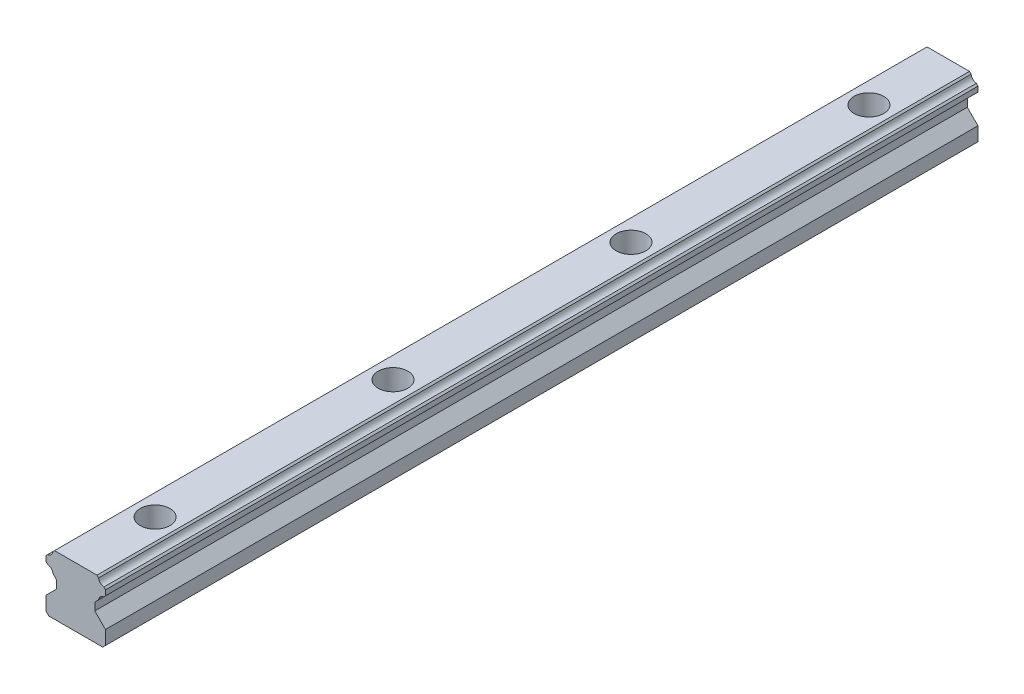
SolidWorks part; units mm, degrees
ref_plane "Front Plane" through (0, 0, 0) normal (0, 0, 1) x (1, 0, 0)
ref_plane "Top Plane" through (0, 0, 0) normal (0, 1, 0) x (1, 0, 0)
ref_plane "Right Plane" through (0, 0, 0) normal (1, 0, 0) x (0, 0, -1)
sketch "Sketch2" plane through (0, 0, 0) normal (0, 0, 1) x (1, 0, 0)
  line L0 (-4.8, 8.84) -> (-4.8, 6.9)
  line L1 (-4.8, 6.9) -> (-7.5, 4.2)
  line L2 (-7.5, 4.2) -> (-7.5, 0.7)
  line L3 (-6.8, 0) -> (-7.5, 0.7)
  line L4 (6.8, 0) -> (-6.8, 0)
  line L5 (7.5, 0.7) -> (6.8, 0)
  line L6 (7.5, 0.7) -> (7.5, 4.2)
  line L7 (7.5, 4.2) -> (4.8, 6.9)
  line L8 (4.8, 6.9) -> (4.8, 8.84)
  line L9 (5.7542, 9.7942) -> (4.8, 8.84)
  line L10 (7.5, 11.54) -> (7.0943, 11.1343)
  line L11 (7.5, 12.85) -> (7.5, 11.54)
  line L12 (7.0816, 13.2684) -> (7.5, 12.85)
  line L13 (5.35, 15) -> (5.7559, 14.5941)
  line L14 (5.35, 15) -> (-5.35, 15)
  line L15 (-5.7559, 14.5941) -> (-5.35, 15)
  line L16 (-7.5, 12.85) -> (-7.0816, 13.2684)
  line L17 (-7.5, 11.54) -> (-7.5, 12.85)
  line L18 (-7.0943, 11.1343) -> (-7.5, 11.54)
  line L19 (-4.8, 8.84) -> (-5.7542, 9.7942)
  arc A0 (7.0943, 11.1343) -> (5.7542, 9.7942) centre (7.3005, 9.588) ccw
  arc A1 (5.7559, 14.5941) -> (7.0816, 13.2684) centre (7.3005, 14.813) ccw
  arc A2 (-7.0816, 13.2684) -> (-5.7559, 14.5941) centre (-7.3005, 14.813) ccw
  arc A3 (-5.7542, 9.7942) -> (-7.0943, 11.1343) centre (-7.3005, 9.588) ccw
extrude "Boss-Extrude1" add sketch "Sketch2" along normal mid plane 220 contours L14 L15 A2 L16 L17 L18 A3 L19 L0 L1 L2 L3 L4 L5 L6 L7 L8 L9 A0 L10 L11 L12 A1 L13
hole_wizard "CBORE for M4 Hex Socket Head Cap Screw1" positions "Sketch3" profile "Sketch4" counterbore size "M4" standard "DIN"
sketch "Sketch3" plane through (0, 15, 0) normal (0, 1, 0) x (1, 0, 0)
  line L0 (5.35, -110) -> (-5.35, -110) construction
  point P0 (0, -90)
  dimension "D1" = 20
sketch "Sketch4" plane through (0, 15, 90) normal (1, 0, 0) x (0, 0, 1)
  line L0 (0, 0) -> (0, 15)
  line L1 (0, 15) -> (2.25, 15)
  line L3 (2.25, 15) -> (2.25, 5.3)
  line L4 (2.25, 5.3) -> (3.75, 5.3)
  line L5 (3.75, 5.3) -> (3.75, 0)
  line L7 (3.75, 0) -> (0, 0)
  line L11 (0, -6.35) -> (0, 107.95) construction
  dimension "Thru Hole Dia." = 4.5
  dimension "Thru Hole Depth" = 15
  dimension "C'Bore Dia." = 7.5
  dimension "C'Bore Depth" = 5.3
pattern_linear "LPattern1" count 4 spacing 60 along (0, 0, -1) of "CBORE for M4 Hex Socket Head Cap Screw1"
